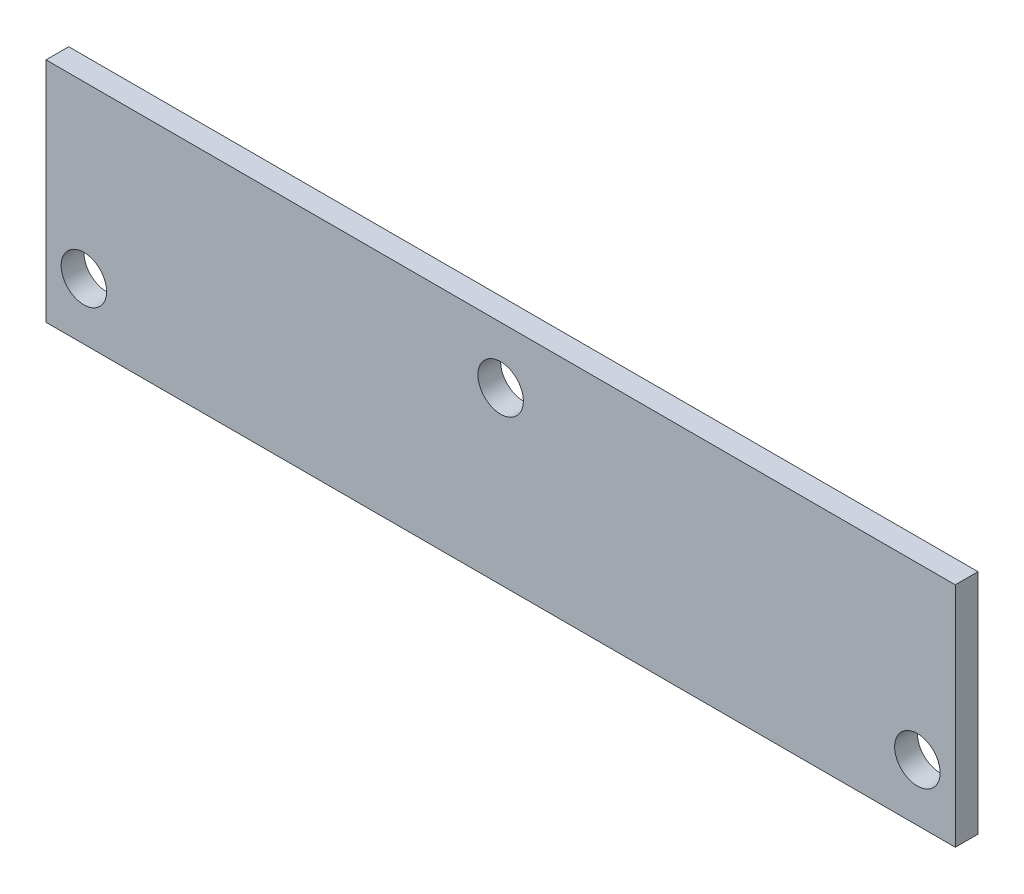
SolidWorks part; units mm, degrees
ref_plane "Alzado" through (0, 0, 0) normal (0, 0, 1) x (1, 0, 0)
ref_plane "Planta" through (0, 0, 0) normal (0, 1, 0) x (1, 0, 0)
ref_plane "Vista lateral" through (0, 0, 0) normal (1, 0, 0) x (0, 0, -1)
sketch "Croquis1" plane through (0, 0, 0) normal (0, 0, 1) x (1, 0, 0)
  line L1 (0, 0) -> (120, 0)
  line L2 (0, 0) -> (0, 30)
  line L3 (0, 30) -> (120, 30)
  line L4 (120, 0) -> (120, 30)
extrude "Saliente-Extruir1" add sketch "Croquis1" along normal blind 3
sketch "Croquis2" plane through (0, 0, 3) normal (0, 0, 1) x (1, 0, 0)
  circle A0 centre (60, 22.5) radius 3
  circle A1 centre (115, 7.5) radius 3
  circle A2 centre (5, 7.5) radius 3
extrude "Cortar-Extruir1" cut sketch "Croquis2" against normal blind 6
